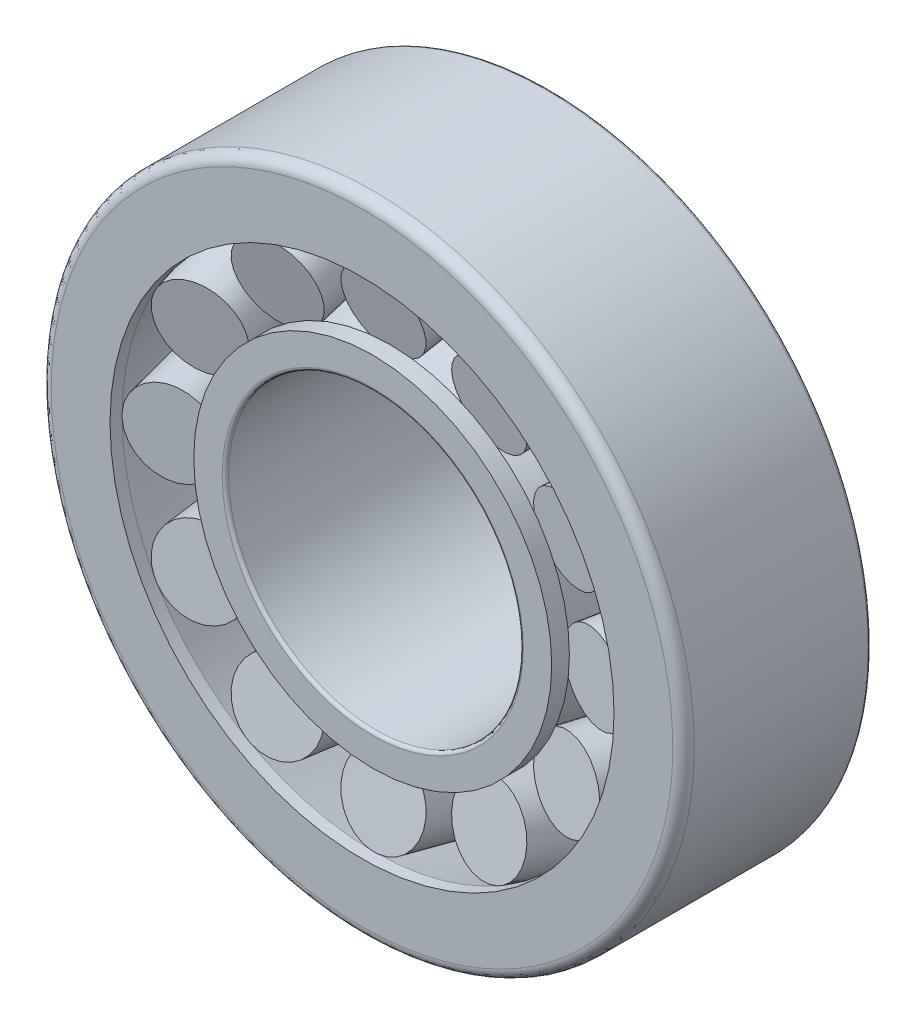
SolidWorks part; units mm, degrees
ref_plane "Front Plane" through (0, 0, 0) normal (0, 0, 1) x (1, 0, 0)
ref_plane "Top Plane" through (0, 0, 0) normal (0, 1, 0) x (1, 0, 0)
ref_plane "Right Plane" through (0, 0, 0) normal (1, 0, 0) x (0, 0, -1)
sketch "BaseSke" plane through (0, 0, 0) normal (1, 0, 0) x (0, 0, -1)
  line L0 (-47.2296, 0) -> (24.6132, 0) construction
  line L2 (0, 129.5214) -> (0, -86.3012) construction
  line L3 (-2.1506, 48.448) -> (-42.8494, 39.052) construction
  line L4 (-45, 60) -> (-10, 60) construction
  line L5 (-43, 27.5) -> (0, 27.5) construction
  line L6 (-22.5, 43.75) -> (-28.5892, 70.1254) construction
  line L7 (-42.75, 47.0507) -> (-12.25, 54.9386)
  line L8 (-12.25, 54.9386) -> (-10.3163, 46.5628)
  line L9 (-10.3163, 46.5628) -> (-41.0018, 39.4785)
  line L10 (-41.0018, 39.4785) -> (-42.75, 47.0507)
  line L11 (-45, 60) -> (-45, 47.0312) construction
  line L12 (-42.7455, 47.0312) -> (-10, 55.4998) construction
  line L13 (-10, 60) -> (-10, 55.4998) construction
  line L14 (-42.7455, 47.0312) -> (-45, 47.0312) construction
  line L15 (-39.2536, 31.9063) -> (-8.3826, 38.1871) construction
  line L16 (-43, 27.5) -> (-43, 33.4063) construction
  line L17 (-43, 33.4063) -> (-39.7026, 33.4063) construction
  line L18 (0, 39.6871) -> (0, 27.5) construction
  line L19 (-39.7026, 33.4063) -> (-39.3629, 31.9351) construction
  line L20 (-39.3629, 31.9351) -> (-8.2958, 38.2558) construction
  line L21 (-8.2958, 38.2558) -> (-8.6263, 39.6871) construction
  line L22 (-8.6263, 39.6871) -> (0, 39.6871) construction
revolve "Roller" add sketch "BaseSke" angle 360 about L3
sketch "OuterRaceSke" plane through (0, 0, 0) normal (1, 0, 0) x (0, 0, -1)
  line L0 (-42.7455, 47.0312) -> (-45, 47.0312) construction
  line L1 (-42.7455, 47.0312) -> (-10, 55.4998) construction
  line L2 (-10, 60) -> (-10, 55.4998) construction
  line L3 (-45, 60) -> (-10, 60) construction
  line L4 (-45, 60) -> (-45, 47.0312) construction
  line L5 (-42.7455, 47.0312) -> (-45, 47.0312)
  line L6 (-42.7455, 47.0312) -> (-10, 55.4998)
  line L7 (-10, 60) -> (-10, 55.4998)
  line L8 (-45, 60) -> (-10, 60)
  line L9 (-45, 60) -> (-45, 47.0312)
  line L10 (-60.3939, 0) -> (35.9926, 0) construction
revolve "OuterRace" add sketch "OuterRaceSke" angle 360 about L10
sketch "InnerRaceSke" plane through (0, 0, 0) normal (1, 0, 0) x (0, 0, -1)
  line L0 (-43, 27.5) -> (0, 27.5) construction
  line L1 (-43, 27.5) -> (-43, 33.4063) construction
  line L2 (-43, 33.4063) -> (-39.7026, 33.4063) construction
  line L3 (-39.7026, 33.4063) -> (-39.3629, 31.9351) construction
  line L4 (-39.3629, 31.9351) -> (-8.2958, 38.2558) construction
  line L5 (-8.2958, 38.2558) -> (-8.6263, 39.6871) construction
  line L6 (-8.6263, 39.6871) -> (0, 39.6871) construction
  line L7 (0, 39.6871) -> (0, 27.5) construction
  line L8 (-43, 27.5) -> (0, 27.5)
  line L9 (-43, 27.5) -> (-43, 33.4063)
  line L10 (-43, 33.4063) -> (-39.7026, 33.4063)
  line L11 (-39.7026, 33.4063) -> (-39.3629, 31.9351)
  line L12 (-39.3629, 31.9351) -> (-8.2958, 38.2558)
  line L13 (-8.2958, 38.2558) -> (-8.6263, 39.6871)
  line L14 (-8.6263, 39.6871) -> (0, 39.6871)
  line L15 (0, 39.6871) -> (0, 27.5)
  line L16 (-58.1022, 0) -> (39.538, 0) construction
revolve "InnerRace" add sketch "InnerRaceSke" angle 360 about L16
fillet "Fillet1" radius 0.6 2 edges at (60, 0, 10) (27.5, 0, 43)
fillet "InnerFillet" radius 2.5 1 edges at (27.5, 0, 0)
fillet "OuterFillet" radius 2 1 edges at (60, 0, 45)
pattern_circular "CirPatternBall" count 12 over 360 about axis through (0, 0, 0) along (0, 0, 1) of "Roller"
sketch "Sketch4" plane through (0, 0, 0) normal (1, 0, 0) x (0, 0, -1)
  line L0 (-42.75, 47.0507) -> (-12.25, 54.9386)
  line L1 (-12.25, 54.9386) -> (-8.3826, 38.1871)
  line L2 (-8.3826, 38.1871) -> (-39.2536, 31.9063)
  line L3 (-39.2536, 31.9063) -> (-42.75, 47.0507)
  line L4 (-40.3293, 0) -> (19.5574, 0) construction
revolve "Simplified" [suppressed] add sketch "Sketch4" angle 360 about L4
equation "\"D2@BaseSke\" = \"Bearing_Thickness@BaseSke\"/2"
equation "\"D3@BaseSke\" =  ( \"Bearing_Outside_Diameter@BaseSke\" + \"Bearing_Inside_Diameter@BaseSke\" )  / 2"
equation "\"Roller_diameter@BaseSke\" = \"D3@BaseSke\"*1.075"
equation "\"D4@BaseSke\" = \"Bearing_Thickness@BaseSke\"/20"
equation "\"D5@BaseSke\" = \"Bearing_Thickness@BaseSke\" / 20"
equation "\"D8@BaseSke\" = \"Bearing_Thickness@BaseSke\"/30"
equation "\"D11@BaseSke\" = \"D8@BaseSke\""
equation "\"D1@CirPatternBall\" = int(  \"D3@BaseSke\" *  pi  /  ( \"Bearing_Outside_Diameter@BaseSke\" - \"Bearing_Inside_Diameter@BaseSke\" )  * 3 ) "
